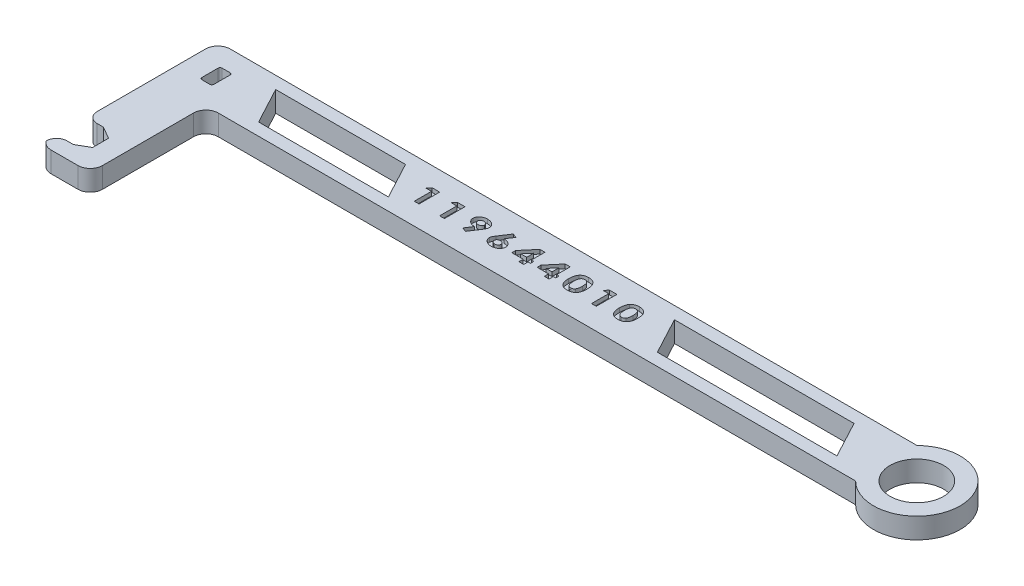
SolidWorks part; units mm, degrees
ref_plane "Front Plane" through (0, 0, 0) normal (0, 0, 1) x (1, 0, 0)
ref_plane "Top Plane" through (0, 0, 0) normal (0, 1, 0) x (1, 0, 0)
ref_plane "Right Plane" through (0, 0, 0) normal (1, 0, 0) x (0, 0, -1)
sketch "Sketch2" plane through (0, 0, 0) normal (0, 1, 0) x (1, 0, 0)
  line L0 (0, 0) -> (0, 14.9)
  line L1 (0, 14.9) -> (167.6008, 14.9)
  line L3 (167.6008, 0) -> (0, 0)
  line L5 (3.55, 5) -> (6.45, 5)
  line L6 (3.55, 5) -> (3.55, 9.9)
  line L7 (3.55, 9.9) -> (6.45, 9.9)
  line L8 (6.45, 5) -> (6.45, 9.9)
  line L9 (3.55, 5) -> (6.45, 9.9) construction
  line L10 (3.55, 9.9) -> (6.45, 5) construction
  circle A0 centre (175, 7.45) radius 6.5
  arc A1 (167.6008, 0) -> (167.6008, 14.9) centre (175, 7.45) ccw
  point P0 (0.1045, 0)
  point P1 (1.673, 14.0891)
  point P3 (5, 7.45)
  point P12 (0, 0)
  point P13 (0, 7.45)
  point P16 (0, 0)
  point P19 (0, 0)
  point P20 (0, 16.3057)
  point P21 (0, 16.2015)
  dimension "D1" = 13
  dimension "D2" = 4
  dimension "D3" = 2.9
  dimension "D4" = 4.9
  dimension "D6" = 5
  dimension "D7" = 5
  dimension "D8" = 170
extrude "Boss-Extrude1" add sketch "Sketch2" along normal blind 5
sketch "Sketch3" plane through (0, 5, 0) normal (0, 1, 0) x (1, 0, 0)
  line L0 (61.8382, 5.2608) -> (121.6269, 5.2608) construction
  text T0 "119644010" font "Century Gothic" height 5
  point P2 (66.7421, 4.7354)
  point P4 (61.8382, 5.2608)
extrude "Cut-Extrude1" cut sketch "Sketch3" against normal blind 1
sketch "Sketch4" plane through (0, 5, 0) normal (0, 1, 0) x (1, 0, 0)
  line L1 (3.55, 9.9) -> (6.45, 9.9) construction
  line L2 (3.55, 9.9) -> (3.55, 5) construction
  line L3 (3.55, 5) -> (6.45, 5) construction
  line L4 (6.45, 9.9) -> (6.45, 5) construction
  circle A0 centre (5, 7.45) radius 3.0878
  point P6 (5, 9.9)
  point P7 (3.55, 7.45)
sketch "Sketch5" plane through (0, 5, 0) normal (0, 1, 0) x (1, 0, 0)
  line L0 (0, 7.45) -> (39.4736, 7.45) construction
  line L1 (29.5, 0) -> (29.5, 4.45) construction
  line L2 (0, 0) -> (167.6008, 0) construction
  line L3 (29.5, 4.45) -> (31.2321, 7.45) construction
  line L4 (31.2321, 7.45) -> (34.7679, 7.45)
  line L5 (34.7679, 7.45) -> (36.5, 4.45) construction
  line L6 (36.5, 4.45) -> (36.5, 0) construction
  line L7 (36.5, 0) -> (29.5, 0) construction
  line L8 (29.35, 4.4902) -> (31.0588, 7.45)
  line L10 (34.9412, 7.45) -> (36.65, 4.4902)
  line L11 (36.65, 4.4902) -> (36.65, 0)
  line L13 (29.35, 0) -> (29.35, 4.4902)
  line L14 (31.2321, 7.45) -> (31.0588, 7.45)
  line L15 (34.7679, 7.45) -> (34.9412, 7.45)
  line L16 (29.35, 0) -> (36.65, 0)
  line L17 (29.35, 4.4902) -> (31.1454, 7.6) construction
  line L18 (34.8546, 7.6) -> (36.65, 4.4902) construction
  line L19 (31.1454, 7.6) -> (34.8546, 7.6) construction
  line L20 (36.65, 4.4902) -> (36.65, -0.15) construction
  line L21 (36.65, -0.15) -> (29.35, -0.15) construction
  line L22 (29.35, -0.15) -> (29.35, 4.4902) construction
  line L23 (0, 14.9) -> (0, 0) construction
  line L24 (6.45, 9.9) -> (3.55, 9.9) construction
  point P13 (33, 7.45)
  point P22 (5, 7.45)
  point P25 (5, 9.9)
  dimension "D1" = 28
  dimension "D2" = 30
  dimension "D3" = 7
  dimension "D4" = 3
  dimension "D5" = 0.15
extrude "Cut-Extrude4" [suppressed] cut sketch "Sketch5" against normal blind 10
fillet "Fillet2" [suppressed] radius 4
fillet "Fillet3" radius 0.5 4 edges at (6.45, 2.5, -5) (3.55, 2.5, -5) (6.45, 2.5, -9.9) (3.55, 2.5, -9.9)
extrude "Cut-Extrude5" [suppressed] cut sketch "Sketch4" against normal blind 10 contours A0
sketch "Sketch6" plane through (0, 5, 0) normal (0, 1, 0) x (1, 0, 0)
  line L0 (5, 9.9) -> (5, -28.05) construction
  line L1 (0, 0) -> (10, 0)
  line L3 (-2, -28.05) -> (10, -28.05)
  line L4 (10, 0) -> (10, -28.05)
  line L5 (0, 14.9) -> (-2, 14.9)
  line L8 (-2, 14.9) -> (-2, -14.4)
  line L9 (5.95, 9.9) -> (4.05, 9.9) construction
  line L10 (5, -18.7821) -> (5, -22.3179)
  line L11 (5, -22.3179) -> (2, -24.05) construction
  line L12 (2, -24.05) -> (-2, -24.05) construction
  line L13 (-2, -24.05) -> (-2, -17.05) construction
  line L14 (-2, -17.05) -> (2, -17.05) construction
  line L15 (2, -17.05) -> (5, -18.7821) construction
  line L16 (3.55, 9.4) -> (3.55, 5.5) construction
  line L17 (0.5, -16.9) -> (2.0402, -16.9)
  line L18 (2.0402, -16.9) -> (5, -18.6088)
  line L20 (5, -22.4912) -> (2.0402, -24.2)
  line L21 (2.0402, -24.2) -> (0.5, -24.2)
  line L23 (5, -18.7821) -> (5, -18.6088)
  line L24 (5, -22.3179) -> (5, -22.4912)
  line L25 (5.15, -22.4046) -> (2.0402, -24.2) construction
  line L26 (2.0402, -16.9) -> (5.15, -18.6954) construction
  line L27 (5.15, -18.6954) -> (5.15, -22.4046) construction
  line L28 (-2, -26.7) -> (-2, -28.05)
  line L29 (-2.15, -24.2) -> (-2.15, -16.9) construction
  line L30 (2.0402, -24.2) -> (-2.15, -24.2) construction
  line L31 (-2.15, -16.9) -> (2.0402, -16.9) construction
  line L32 (0, 14.9) -> (0, 0)
  arc A0 (0.5, -24.2) -> (-2, -26.7) centre (0.5, -26.7) ccw
  arc A1 (0.5, -16.9) -> (-2, -14.4) centre (0.5, -14.4) cw
  point P15 (-2, -20.55)
  point P20 (5, -20.55)
  point P22 (3.55, 7.45)
  dimension "D9" = 2.5
  dimension "D1" = 30
  dimension "D2" = 3
  dimension "D3" = 7
  dimension "D4" = 28
  dimension "D5" = 2
  dimension "D6" = 5
  dimension "D7" = 4
  dimension "D8" = 0.15
extrude "Boss-Extrude2" add sketch "Sketch6" against normal blind 5
fillet "Fillet4" radius 3 4 edges at (-2, 2.5, -14.9) (10, 2.5, 0) (10, 2.5, 28.05) (-2, 2.5, 28.05)
sketch "Sketch7" plane through (0, 5, 0) normal (0, 1, 0) x (1, 0, 0)
  line L0 (19.789, 3) -> (15.031, 11.9)
  line L1 (15.031, 11.9) -> (46.514, 11.9)
  line L2 (46.514, 11.9) -> (51.2719, 3)
  line L3 (51.2719, 3) -> (19.789, 3)
  line L4 (167.6008, 14.9) -> (1, 14.9) construction
  line L5 (13, 0) -> (167.6008, 0) construction
  line L6 (116.513, 3) -> (111.7551, 11.9)
  line L7 (111.7551, 11.9) -> (155.316, 11.9)
  line L8 (155.316, 11.9) -> (160.0739, 3)
  line L9 (160.0739, 3) -> (116.513, 3)
  dimension "D1" = 3
  dimension "D2" = 3
  dimension "D3" = 3
  dimension "D4" = 3
extrude "Cut-Extrude6" cut sketch "Sketch7" against normal blind 14
